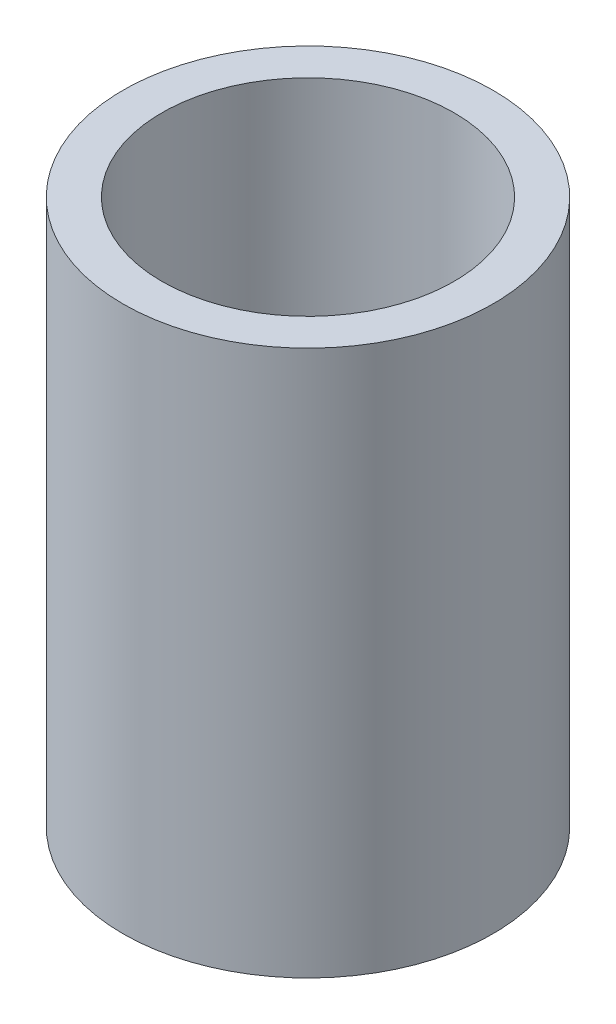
SolidWorks part; units mm, degrees
ref_plane "Front Plane" through (0, 0, 0) normal (0, 0, 1) x (1, 0, 0)
ref_plane "Top Plane" through (0, 0, 0) normal (0, 1, 0) x (1, 0, 0)
ref_plane "Right Plane" through (0, 0, 0) normal (1, 0, 0) x (0, 0, -1)
sketch "Sketch3" plane through (0, 0, 0) normal (0, 1, 0) x (1, 0, 0)
  circle A0 centre (0, 0) radius 30.1625
extrude "Extrude1" add sketch "Sketch3" along normal blind 88.9
sketch "Sketch4" plane through (0, 0, 0) normal (0, -1, 0) x (1, 0, 0)
  circle A0 centre (0, 0) radius 23.8125
extrude "Cut-Extrude1" cut sketch "Sketch4" against normal blind 88.9
